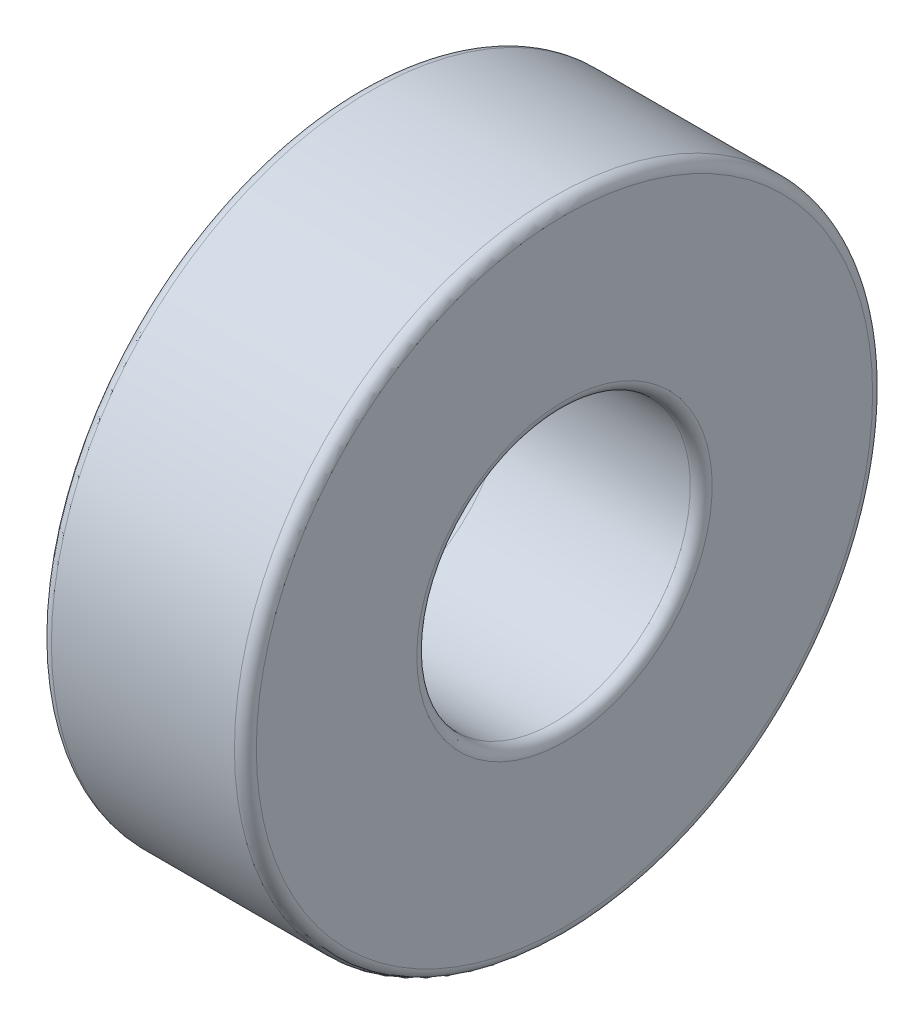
SolidWorks part; units mm, degrees
ref_plane "Front Plane" through (0, 0, 0) normal (0, 0, 1) x (1, 0, 0)
ref_plane "Top Plane" through (0, 0, 0) normal (0, 1, 0) x (1, 0, 0)
ref_plane "Right Plane" through (0, 0, 0) normal (1, 0, 0) x (0, 0, -1)
sketch "Sketch1" plane through (0, 0, 0) normal (0, 0, 1) x (1, 0, 0)
  line L0 (0, 0) -> (51.6202, 0) construction
  line L1 (0, 4.7625) -> (7.1374, 4.7625)
  line L2 (7.1374, 4.7625) -> (7.1374, 11.1125)
  line L3 (7.1374, 11.1125) -> (0, 11.1125)
  line L4 (0, 11.1125) -> (0, 4.7625)
  dimension "D1" = 9.525
  dimension "D2" = 22.225
  dimension "D3" = 7.1374
revolve "Revolve1" add sketch "Sketch1" angle 360 about L0
fillet "Fillet1" radius 0.381 4 edges at (7.1374, 0, 4.7625) (7.1374, 0, 11.1125) (0, 0, 4.7625) (0, 0, 11.1125)
